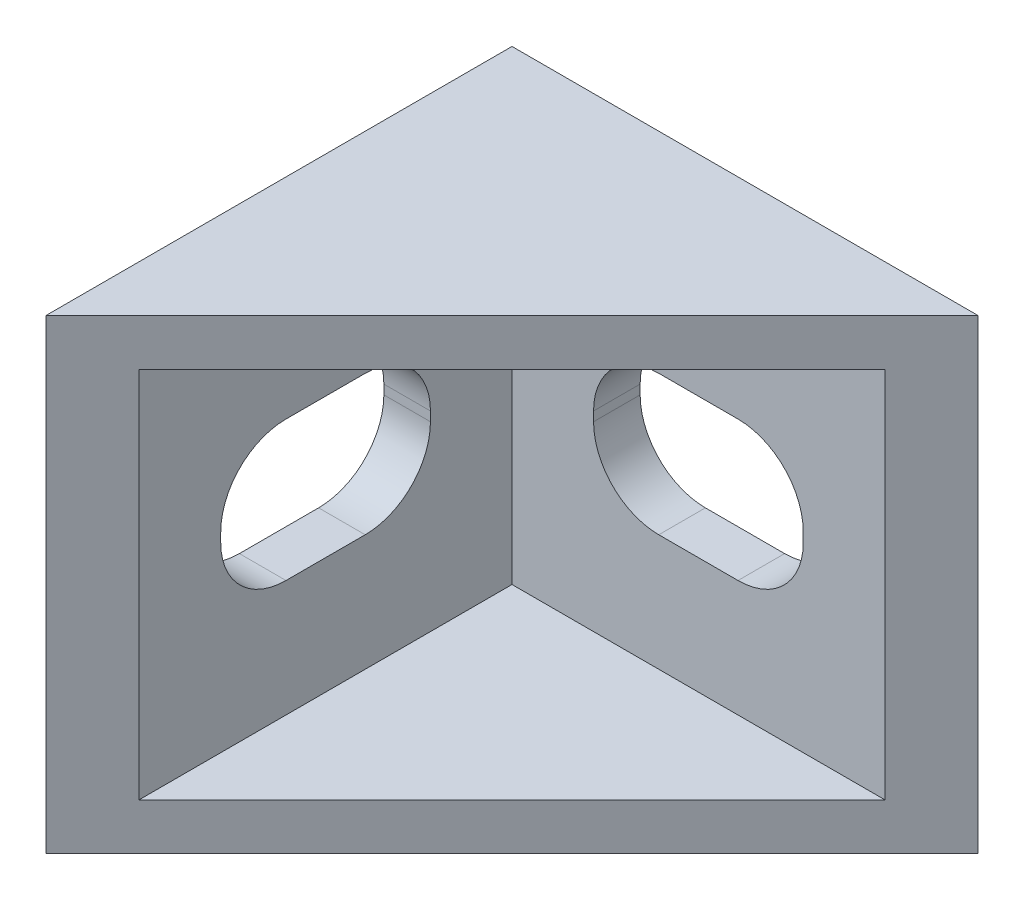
SolidWorks part; units mm, degrees
ref_plane "Alzado" through (0, 0, 0) normal (0, 0, 1) x (1, 0, 0)
ref_plane "Planta" through (0, 0, 0) normal (0, 1, 0) x (1, 0, 0)
ref_plane "Vista lateral" through (0, 0, 0) normal (1, 0, 0) x (0, 0, -1)
sketch "Croquis1" plane through (0, 0, 0) normal (0, 1, 0) x (1, 0, 0)
  line L0 (0, -20) -> (20, 0)
  line L1 (0, 0) -> (20, 0)
  line L2 (0, 0) -> (0, -20)
  dimension "D1" = 20
  dimension "D2" = 20
extrude "Saliente-Extruir1" add sketch "Croquis1" along normal blind 20
shell "Vaciado1" thickness 2
sketch "Croquis2" plane through (2, 0, 0) normal (1, 0, 0) x (0, 0, -1)
  line L0 (-18, 10) -> (-2, 10) construction
  line L1 (-18, 18) -> (-18, 2) construction
  line L2 (-2, 18) -> (-2, 2) construction
  line L3 (-10, 18) -> (-10, 2) construction
  line L4 (-2, 18) -> (-18, 18) construction
  line L5 (-18, 2) -> (-2, 2) construction
  line L7 (-11.7, 7) -> (-8.3, 7)
  line L8 (-14.5, 9.8) -> (-14.5, 10.2)
  line L9 (-11.7, 13) -> (-8.3, 13)
  line L10 (-5.5, 9.8) -> (-5.5, 10.2)
  line L11 (-14.5, 7) -> (-5.5, 13) construction
  line L12 (-14.5, 13) -> (-5.5, 7) construction
  arc A0 (-8.3, 13) -> (-5.5, 10.2) centre (-8.3, 10.2) cw
  arc A1 (-5.5, 9.8) -> (-8.3, 7) centre (-8.3, 9.8) cw
  arc A2 (-11.7, 7) -> (-14.5, 9.8) centre (-11.7, 9.8) cw
  arc A3 (-14.5, 10.2) -> (-11.7, 13) centre (-11.7, 10.2) cw
  point P12 (-10, 10)
  dimension "D3" = 2.8
  dimension "D1" = 6
  dimension "D2" = 9
extrude "Cortar-Extruir1" cut sketch "Croquis2" against normal blind 10
sketch "Croquis3" plane through (0, 0, 2) normal (0, 0, 1) x (1, 0, 0)
  line L0 (2, 10) -> (18, 10) construction
  line L1 (2, 18) -> (2, 2) construction
  line L2 (18, 18) -> (18, 2) construction
  line L3 (10, 18) -> (10, 2) construction
  line L4 (2, 18) -> (18, 18) construction
  line L5 (2, 2) -> (18, 2) construction
  line L7 (8.3, 7) -> (11.7, 7)
  line L8 (5.5, 9.8) -> (5.5, 10.2)
  line L9 (8.3, 13) -> (11.7, 13)
  line L10 (14.5, 9.8) -> (14.5, 10.2)
  line L11 (5.5, 7) -> (14.5, 13) construction
  line L12 (5.5, 13) -> (14.5, 7) construction
  arc A0 (14.5, 10.2) -> (11.7, 13) centre (11.7, 10.2) ccw
  arc A1 (14.5, 9.8) -> (11.7, 7) centre (11.7, 9.8) cw
  arc A2 (8.3, 7) -> (5.5, 9.8) centre (8.3, 9.8) cw
  arc A3 (5.5, 10.2) -> (8.3, 13) centre (8.3, 10.2) cw
  point P12 (10, 10)
  dimension "D3" = 2.8
  dimension "D1" = 6
  dimension "D2" = 9
extrude "Cortar-Extruir2" cut sketch "Croquis3" against normal blind 10
